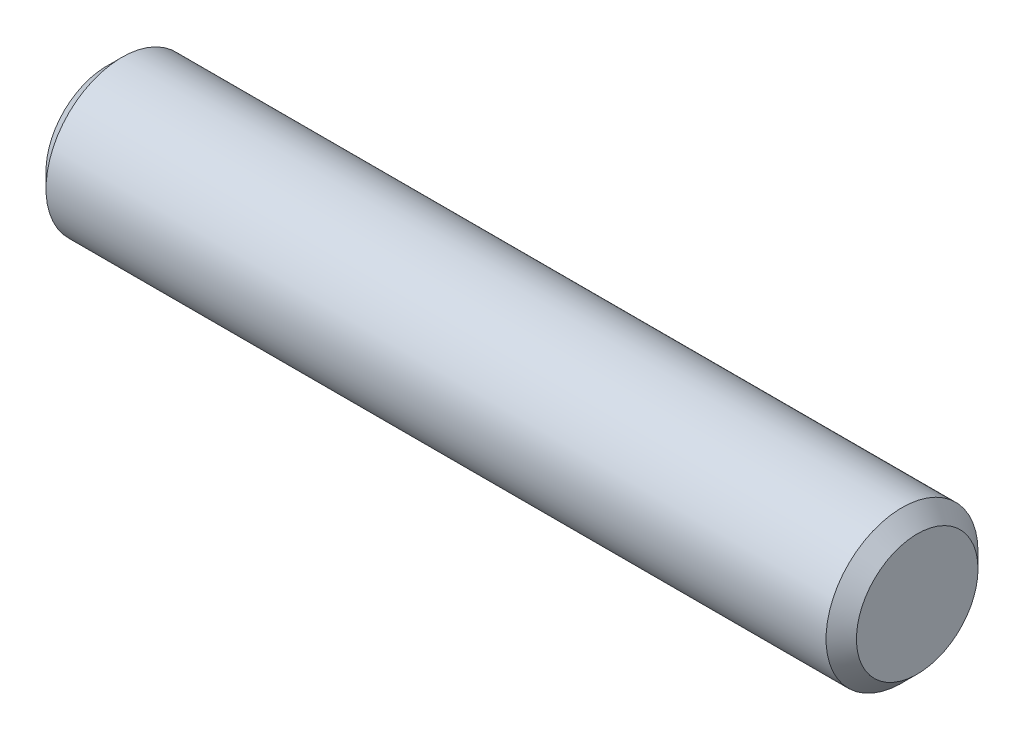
SolidWorks part; units mm, degrees
ref_plane "Front" through (0, 0, 0) normal (0, 0, 1) x (1, 0, 0)
ref_plane "Top" through (0, 0, 0) normal (0, 1, 0) x (1, 0, 0)
ref_plane "Right" through (0, 0, 0) normal (1, 0, 0) x (0, 0, -1)
sketch "Sketch1" plane through (0, 0, 0) normal (0, 0, 1) x (1, 0, 0)
  line L0 (-3.175, 0) -> (3.175, 0) construction
  line L1 (3.175, 0.5953) -> (3.175, -0.5953) construction
  line L2 (-3.175, 0.5953) -> (-3.175, -0.5953) construction
sketch "Sketch2" plane through (0, 0, 0) normal (1, 0, 0) x (0, 0, -1)
  circle A0 centre (0, 0) radius 0.5953
extrude "Extrude1" add sketch "Sketch2" against normal up to vertex (3.175 mm away) and the other way up to vertex (3.175 mm away)
chamfer "Chamfer1" distance 0.1191 angle 45 2 edges at (3.175, 0, -0.5953) (-3.175, 0, -0.5953)
equation "\"D1@Chamfer1\" = \"Diameter@Sketch1\"*.1"
